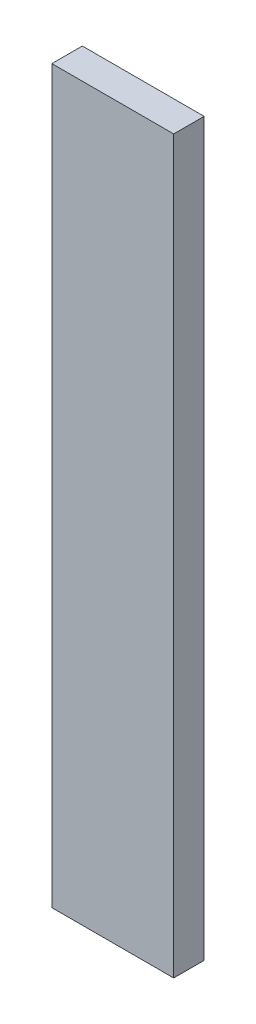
SolidWorks part; units mm, degrees
ref_plane "Front Plane" through (0, 0, 0) normal (0, 0, 1) x (1, 0, 0)
ref_plane "Top Plane" through (0, 0, 0) normal (0, 1, 0) x (1, 0, 0)
ref_plane "Right Plane" through (0, 0, 0) normal (1, 0, 0) x (0, 0, -1)
sketch "Sketch1" plane through (0, 0, 0) normal (0, 0, 1) x (1, 0, 0)
  line L0 (0, 0) -> (12.7, 0)
  line L1 (12.7, 0) -> (12.7, 76.2)
  line L2 (12.7, 76.2) -> (0, 76.2)
  line L3 (0, 76.2) -> (0, 0)
  dimension "D1" = 76.2
  dimension "D2" = 12.7
extrude "Boss-Extrude1" add sketch "Sketch1" along normal blind 3.175
